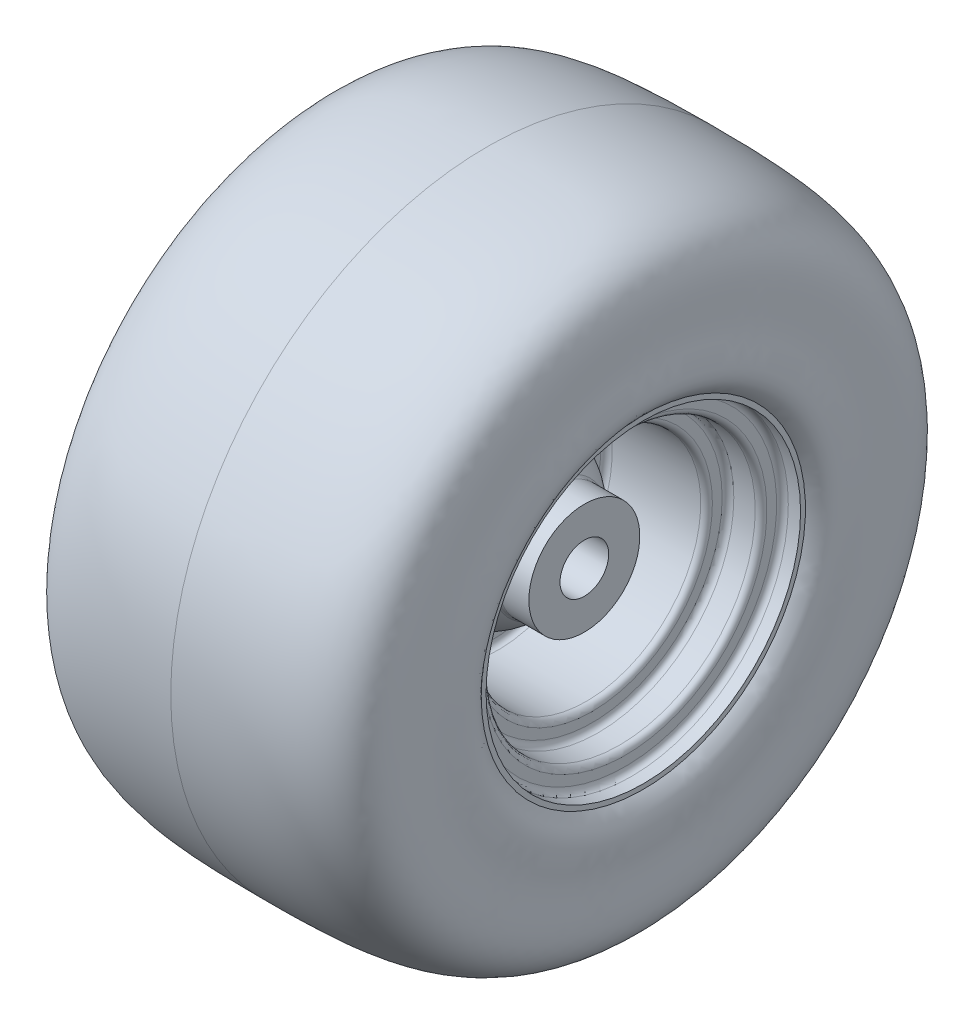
SolidWorks part; units mm, degrees
ref_plane "Plan de face" through (0, 0, 0) normal (0, 0, 1) x (1, 0, 0)
ref_plane "Plan de dessus" through (0, 0, 0) normal (0, 1, 0) x (1, 0, 0)
ref_plane "Plan de droite" through (0, 0, 0) normal (1, 0, 0) x (0, 0, -1)
sketch "Esquisse1" plane through (0, 0, 0) normal (0, 1, 0) x (1, 0, 0)
  line L0 (-43.3522, 0) -> (43.3522, 0) construction
  line L1 (-50, 28.5) -> (-50, 12.5)
  line L2 (-50, 28.5) -> (-34.3795, 28.5)
  line L3 (-2.5, 47.4668) -> (-2.5, 55.8)
  line L4 (-5.5, 58.8) -> (-51, 58.8)
  line L5 (-54, 61.8) -> (-54, 66.8)
  line L6 (-57, 69.8) -> (-68, 69.8)
  line L7 (-71, 72.8) -> (-71, 77.8)
  line L8 (-74, 80.8) -> (-80.3, 80.8)
  line L9 (-80.3, 80.8) -> (-80.3, 83.3)
  line L10 (0, 162.5) -> (0, 0) construction
  line L11 (-50, 12.5) -> (50, 12.5)
  line L12 (80.3, 80.8) -> (80.3, 83.3)
  line L13 (74, 80.8) -> (80.3, 80.8)
  line L14 (71, 72.8) -> (71, 77.8)
  line L15 (57, 69.8) -> (68, 69.8)
  line L16 (54, 61.8) -> (54, 66.8)
  line L17 (5.5, 58.8) -> (51, 58.8)
  line L18 (2.5, 47.4668) -> (2.5, 55.8)
  line L19 (50, 28.5) -> (34.3795, 28.5)
  line L20 (50, 28.5) -> (50, 12.5)
  arc A0 (-32.2367, 29.4004) -> (-4.8613, 44.5356) centre (6.7621, -8.8129) cw
  arc A1 (34.3795, 28.5) -> (32.2367, 29.4004) centre (34.3795, 31.5) cw
  arc A2 (-71, 77.8) -> (-74, 80.8) centre (-74, 77.8) ccw
  arc A3 (-68, 69.8) -> (-71, 72.8) centre (-68, 72.8) cw
  arc A4 (-54, 66.8) -> (-57, 69.8) centre (-57, 66.8) ccw
  arc A5 (-51, 58.8) -> (-54, 61.8) centre (-51, 61.8) cw
  arc A6 (-2.5, 55.8) -> (-5.5, 58.8) centre (-5.5, 55.8) ccw
  arc A7 (-4.8613, 44.5356) -> (-2.5, 47.4668) centre (-5.5, 47.4668) ccw
  arc A8 (-34.3795, 28.5) -> (-32.2367, 29.4004) centre (-34.3795, 31.5) ccw
  arc A9 (4.8613, 44.5356) -> (2.5, 47.4668) centre (5.5, 47.4668) cw
  arc A10 (2.5, 55.8) -> (5.5, 58.8) centre (5.5, 55.8) cw
  arc A11 (51, 58.8) -> (54, 61.8) centre (51, 61.8) ccw
  arc A12 (54, 66.8) -> (57, 69.8) centre (57, 66.8) cw
  arc A13 (68, 69.8) -> (71, 72.8) centre (68, 72.8) ccw
  arc A14 (71, 77.8) -> (74, 80.8) centre (74, 77.8) cw
  arc A15 (32.2367, 29.4004) -> (4.8613, 44.5356) centre (-6.7621, -8.8129) ccw
  spline S0 degree 3 poles (-80.3, 83.3) (-81.7917, 84.7462) (-88.0412, 90.805) (-82.3574, 111.706) (-90.9745, 162.1341) (-38.3567, 162.3457) (0, 162.5) knots 0 0 0 0 0.041867 0.175409 0.398899 1 1 1 1
  spline S1 degree 3 poles (80.3, 83.3) (81.7917, 84.7462) (88.0412, 90.805) (82.3574, 111.706) (90.9745, 162.1341) (38.3567, 162.3457) (0, 162.5) knots 0 0 0 0 0.041867 0.175409 0.398899 1 1 1 1
  point P29 (0, 12.5)
  point P38 (-71, 80.8)
  point P41 (-71, 69.8)
  point P44 (-54, 69.8)
  point P47 (-54, 58.8)
  point P50 (-2.5, 58.8)
  point P53 (-2.5, 44.9958)
  point P56 (-33.099, 28.5)
  point P71 (33.099, 28.5)
  point P72 (2.5, 44.9958)
  point P73 (2.5, 58.8)
  point P74 (54, 58.8)
  point P75 (54, 69.8)
  point P76 (71, 69.8)
  point P77 (71, 80.8)
  dimension "D19" = 54.6
  dimension "D22" = 3
  dimension "D1" = 100
  dimension "D2" = 12.5
  dimension "D3" = 16
  dimension "D4" = 58.8
  dimension "D5" = 69.8
  dimension "D6" = 80.8
  dimension "D7" = 2.5
  dimension "D8" = 162.5
  dimension "D9" = 83.1685
  dimension "D10" = 84.8
  dimension "D11" = 23.4127
  dimension "D12" = 55.4952
  dimension "D13" = 80.3
  dimension "D14" = 71
  dimension "D15" = 54
  dimension "D16" = 2.5
  dimension "D17" = 74.6831
  dimension "D18" = 84.2766
revolve "Révolution1" add sketch "Esquisse1" angle 360 about L0
